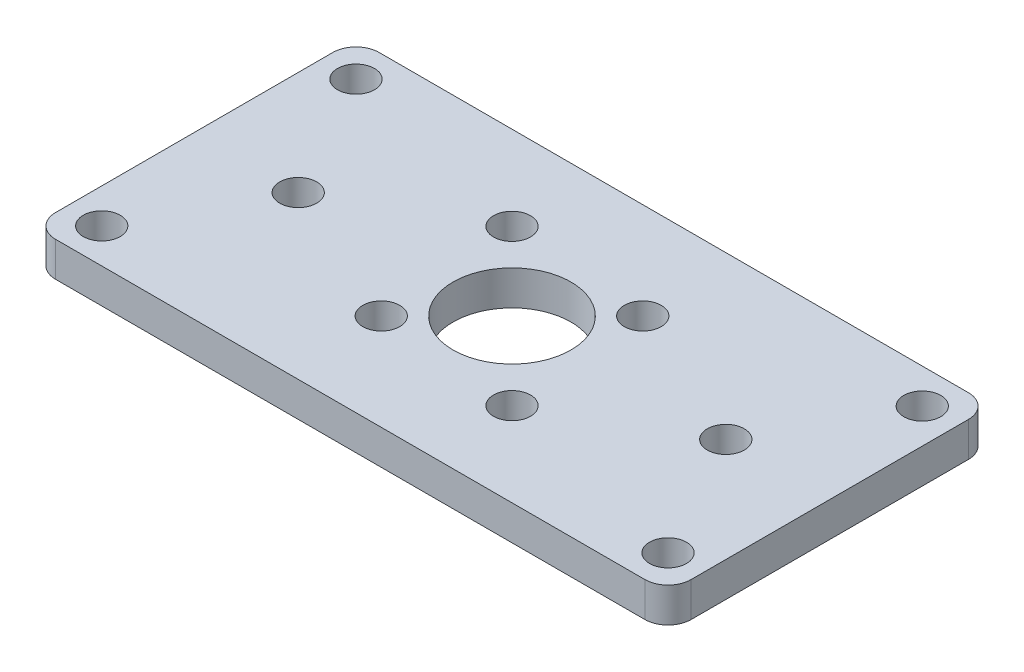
SolidWorks part; units mm, degrees
ref_plane "前视基准面" through (0, 0, 0) normal (0, 0, 1) x (1, 0, 0)
ref_plane "上视基准面" through (0, 0, 0) normal (0, 1, 0) x (1, 0, 0)
ref_plane "右视基准面" through (0, 0, 0) normal (1, 0, 0) x (0, 0, -1)
other "Configuration Table"
sketch "草图1" plane through (0, 0, 0) normal (0, 1, 0) x (1, 0, 0)
  line L0 (0, 0) -> (5.6569, 5.6569) construction
  line L1 (-27.5, -14) -> (27.5, -14)
  line L2 (-27.5, -14) -> (-27.5, 14)
  line L3 (-27.5, 14) -> (27.5, 14)
  line L4 (27.5, -14) -> (27.5, 14)
  line L5 (-27.5, -14) -> (27.5, 14) construction
  line L6 (-27.5, 14) -> (27.5, -14) construction
  line L7 (0, 0) -> (27.5, 0) construction
  line L8 (6.7175, -6.7175) -> (0, 0) construction
  circle A0 centre (0, 0) radius 5.1
  circle A1 centre (0, 0) radius 8 construction
  circle A6 centre (0, 0) radius 9.5 construction
  circle A11 centre (5.6569, 5.6569) radius 1.6
  circle A13 centre (5.6569, -5.6569) radius 1.6 construction
  circle A14 centre (-5.6569, -5.6569) radius 1.6
  circle A15 centre (-5.6569, 5.6569) radius 1.6 construction
  circle A16 centre (6.7175, -6.7175) radius 1.6
  circle A17 centre (-6.7175, -6.7175) radius 1.6 construction
  circle A18 centre (-6.7175, 6.7175) radius 1.6
  circle A19 centre (6.7175, 6.7175) radius 1.6 construction
  point P0 (0, 0)
  point P14 (0, 0)
  point P17 (0, 0)
  point P20 (0, 0)
  point P23 (0, 0)
  point P28 (0, 0)
  point P41 (0, 0)
  dimension "D3" = 10.2
  dimension "D4" = 16
  dimension "D5" = 3.2
  dimension "D7" = 19
  dimension "D1" = 28
  dimension "D2" = 55
  dimension "D8" = 45
  dimension "D9" = 4
  dimension "D10" = 90
  dimension "D6" = 4
  dimension "D11" = 4
extrude "凸台-拉伸1" add sketch "草图1" along normal blind 3
sketch "草图2" plane through (0, 3, 0) normal (0, 1, 0) x (1, 0, 0)
  line L0 (27.5, -14) -> (27.5, 14) construction
  line L1 (-27.5, -8) -> (27.5, -8) construction
  line L2 (-27.5, -8) -> (-27.5, 8) construction
  line L3 (-27.5, 8) -> (27.5, 8) construction
  line L4 (27.5, -8) -> (27.5, 8) construction
  line L5 (-27.5, -8) -> (27.5, 8) construction
  line L6 (-27.5, 8) -> (27.5, -8) construction
  line L7 (27.5, 8) -> (27.5, 14) construction
  line L8 (27.5, 14) -> (-27.5, 14) construction
  line L9 (27.5, 11) -> (-27.5, 11) construction
  line L10 (-27.5, 14) -> (-27.5, -14) construction
  line L11 (0, 14) -> (0, -14) construction
  line L12 (-27.5, -14) -> (27.5, -14) construction
  line L13 (-27.5, 0) -> (27.5, 0) construction
  circle A4 centre (-24.5, 11) radius 1.6
  circle A5 centre (-24.5, -11) radius 1.6
  circle A6 centre (24.5, 11) radius 1.6
  circle A7 centre (24.5, -11) radius 1.6
  circle A8 centre (422.7031, 0) radius 1.6 construction
  circle A9 centre (422.7031, 0) radius 1.6
  circle A10 centre (18.5, 0) radius 1.6
  circle A11 centre (-18.5, 0) radius 1.6
  point P0 (0, 0)
  dimension "D2" = 3.2
  dimension "D4" = 3.2
  dimension "D7" = 3
  dimension "D1" = 16
  dimension "D5" = 3
  dimension "D6" = 3
  dimension "D8" = 3
extrude "切除-拉伸1" cut sketch "草图2" against normal through all
fillet "圆角1" radius 2 4 edges at (27.5, 1.5, 14) (-27.5, 1.5, 14) (27.5, 1.5, -14) (-27.5, 1.5, -14)
